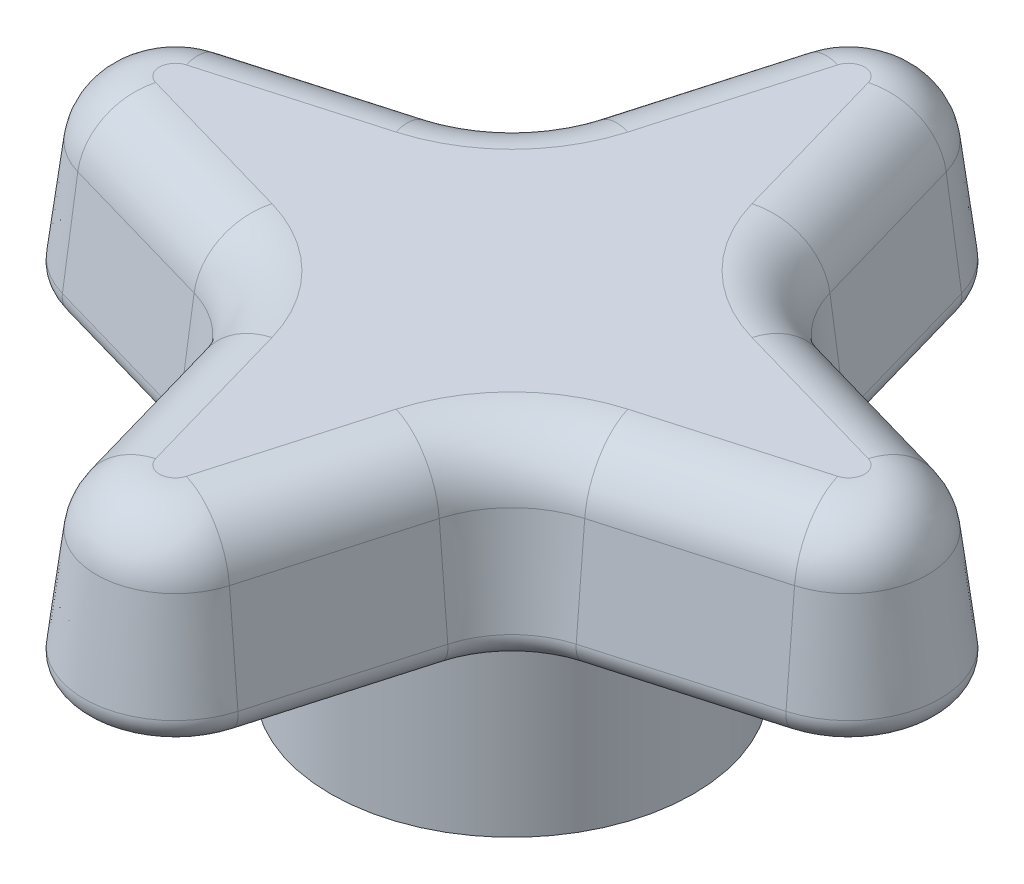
SolidWorks part; units mm, degrees
ref_plane "Front" through (0, 0, 0) normal (0, 0, 1) x (1, 0, 0)
ref_plane "Top" through (0, 0, 0) normal (0, 1, 0) x (1, 0, 0)
ref_plane "Right" through (0, 0, 0) normal (1, 0, 0) x (0, 0, -1)
sketch "Sketch1" plane through (0, 0, 0) normal (0, 1, 0) x (1, 0, 0)
  line L0 (30.5652, 0) -> (-30.5652, 0) construction
  line L1 (0, 33.378) -> (0, -33.378) construction
  line L2 (0, 0) -> (19.783, 19.783) construction
  line L3 (3.175, 12.7) -> (4.8125, 6.9894)
  line L4 (12.7, 3.175) -> (6.9894, 4.8125)
  line L5 (12.7, -3.175) -> (6.9894, -4.8125)
  line L6 (3.175, -12.7) -> (4.8125, -6.9894)
  line L7 (-3.175, -12.7) -> (-4.8125, -6.9894)
  line L8 (-12.7, -3.175) -> (-6.9894, -4.8125)
  line L9 (-12.7, 3.175) -> (-6.9894, 4.8125)
  line L10 (-3.175, 12.7) -> (-4.8125, 6.9894)
  arc A0 (4.8125, 6.9894) -> (6.9894, 4.8125) centre (7.8645, 7.8645) ccw
  arc A1 (4.8125, -6.9894) -> (6.9894, -4.8125) centre (7.8645, -7.8645) cw
  arc A2 (-4.8125, -6.9894) -> (-6.9894, -4.8125) centre (-7.8645, -7.8645) ccw
  arc A3 (-4.8125, 6.9894) -> (-6.9894, 4.8125) centre (-7.8645, 7.8645) cw
  arc A4 (-3.175, 12.7) -> (3.175, 12.7) centre (0, 11.7896) cw
  arc A5 (-12.7, 3.175) -> (-12.7, -3.175) centre (-11.7896, 0) ccw
  arc A6 (-3.175, -12.7) -> (3.175, -12.7) centre (0, -11.7896) ccw
  arc A7 (12.7, -3.175) -> (12.7, 3.175) centre (11.7896, 0) ccw
  dimension "D5" = 3.175
  dimension "D1" = 45
  dimension "D2" = 16
  dimension "D3" = 6.35
  dimension "D4" = 12.7
extrude "Extrude1" add sketch "Sketch1" along normal blind 6.35 draft 7
fillet "Fillet1" radius 2.2225
sketch "Sketch2" plane through (0, 0, 0) normal (0, -1, 0) x (1, 0, 0)
  circle A0 centre (0, 0) radius 4.9213
  circle A1 centre (0, 0) radius 6.35
  dimension "D1" = 12.7
  dimension "D2" = 9.8425
extrude "Extrude2" add sketch "Sketch2" along normal blind 6.35
fillet "Fillet2" radius 0.762
